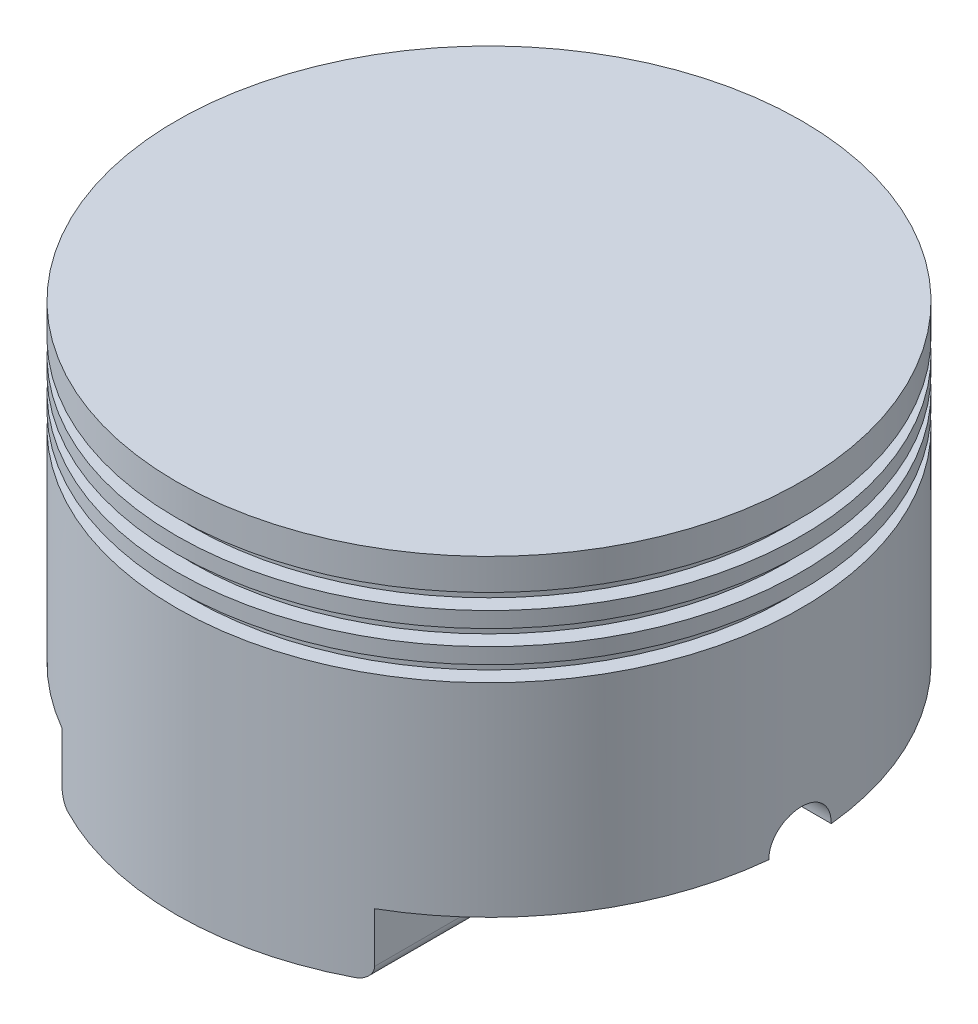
SolidWorks part; units mm, degrees
ref_plane "Front Plane" through (0, 0, 0) normal (0, 0, 1) x (1, 0, 0)
ref_plane "Top Plane" through (0, 0, 0) normal (0, 1, 0) x (1, 0, 0)
ref_plane "Right Plane" through (0, 0, 0) normal (1, 0, 0) x (0, 0, -1)
sketch "Sketch1" plane through (0, 0, 0) normal (0, 0, 1) x (1, 0, 0)
  line L0 (-31.75, 31.75) -> (-31.75, 38.1)
  line L1 (-31.75, -38.1) -> (31.75, -38.1)
  line L2 (-31.75, -38.1) -> (-31.75, 15.875)
  line L3 (-31.75, 38.1) -> (31.75, 38.1)
  line L4 (31.75, -38.1) -> (31.75, 38.1)
  line L5 (-31.75, -38.1) -> (31.75, 38.1) construction
  line L6 (-31.75, 38.1) -> (31.75, -38.1) construction
  line L7 (-31.75, 31.75) -> (-28.575, 31.75)
  line L9 (-31.75, 28.575) -> (-28.575, 28.575)
  line L10 (-28.575, 31.75) -> (-28.575, 28.575)
  line L11 (-31.75, 31.75) -> (-28.575, 28.575) construction
  line L12 (-31.75, 28.575) -> (-28.575, 31.75) construction
  line L13 (-31.75, 25.4) -> (-28.575, 25.4)
  line L15 (-31.75, 22.225) -> (-28.575, 22.225)
  line L16 (-28.575, 25.4) -> (-28.575, 22.225)
  line L17 (-31.75, 25.4) -> (-28.575, 22.225) construction
  line L18 (-31.75, 22.225) -> (-28.575, 25.4) construction
  line L19 (-31.75, 19.05) -> (-28.575, 19.05)
  line L21 (-31.75, 15.875) -> (-28.575, 15.875)
  line L22 (-28.575, 19.05) -> (-28.575, 15.875)
  line L23 (-31.75, 19.05) -> (-28.575, 15.875) construction
  line L24 (-31.75, 15.875) -> (-28.575, 19.05) construction
  line L25 (-31.75, 25.4) -> (-31.75, 28.575)
  line L26 (-31.75, 19.05) -> (-31.75, 22.225)
  point P0 (0, 0)
  point P5 (-30.1625, 30.1625)
  point P11 (-30.1625, 23.8125)
  point P16 (-30.1625, 17.4625)
  point P21 (0, 0)
  point P22 (-30.1625, 30.1625)
  point P23 (-30.1625, 23.8125)
  point P24 (-30.1625, 17.4625)
  point P25 (0, 0)
  dimension "D1" = 76.2
  dimension "D2" = 63.5
  dimension "D3" = 3.175
  dimension "D4" = 6.35
  dimension "D5" = 3.175
  dimension "D6" = 3.175
  dimension "D7" = 3.175
  dimension "D8" = 3.175
  dimension "D9" = 3.175
  dimension "D10" = 3.175
  dimension "D11" = 3.175
revolve "Revolve1" add sketch "Sketch1" angle 360 about L4
sketch "Sketch2" plane through (0, -38.1, 0) normal (0, -1, 0) x (1, 0, 0)
  circle A0 centre (31.75, 0) radius 57.15
  dimension "D1" = 114.3
extrude "Cut-Extrude1" cut sketch "Sketch2" against normal blind 50.8
sketch "Sketch5" plane through (0, 0, 0) normal (0, 0, 1) x (1, 0, 0)
  line L1 (0, -25.4) -> (-63.5, -25.4)
  line L2 (0, -25.4) -> (0, -50.8)
  line L3 (0, -50.8) -> (-63.5, -50.8)
  line L4 (-63.5, -25.4) -> (-63.5, -50.8)
  line L5 (0, -25.4) -> (-63.5, -50.8) construction
  line L6 (0, -50.8) -> (-63.5, -25.4) construction
  line L7 (63.5, -50.8) -> (127, -50.8)
  line L8 (63.5, -50.8) -> (63.5, -25.4)
  line L9 (63.5, -25.4) -> (127, -25.4)
  line L10 (127, -50.8) -> (127, -25.4)
  line L11 (63.5, -50.8) -> (127, -25.4) construction
  line L12 (63.5, -25.4) -> (127, -50.8) construction
  point P0 (-31.75, -38.1)
  point P5 (95.25, -38.1)
  dimension "D1" = 25.4
  dimension "D2" = 63.5
  dimension "D3" = 25.4
  dimension "D4" = 63.5
extrude "Cut-Extrude3" cut sketch "Sketch5" against normal through all both and the other way through all
sketch "Sketch6" plane through (0, 12.7, 0) normal (0, -1, 0) x (1, 0, 0)
  line L0 (0, 54.9926) -> (0, 47.519) construction
  line L1 (12.7, 25.4) -> (6.35, 25.4)
  line L2 (12.7, 25.4) -> (12.7, -25.4)
  line L3 (12.7, -25.4) -> (6.35, -25.4)
  line L4 (0, 25.4) -> (0, -25.4)
  line L5 (12.7, 25.4) -> (0, -25.4) construction
  line L6 (12.7, -25.4) -> (0, 25.4) construction
  line L7 (0, 25.4) -> (0, 47.519)
  line L8 (6.35, 25.4) -> (6.35, 51.1953)
  line L9 (6.35, -25.4) -> (6.35, -51.1953)
  line L10 (0, -25.4) -> (0, -47.519)
  line L11 (31.75, 57.15) -> (31.75, -57.15) construction
  line L12 (50.8, -25.4) -> (57.15, -25.4)
  line L13 (57.15, -25.4) -> (57.15, -51.1953)
  line L14 (63.5, -25.4) -> (63.5, -47.519)
  line L15 (63.5, 25.4) -> (63.5, -25.4)
  line L16 (63.5, 25.4) -> (63.5, 47.519)
  line L17 (57.15, 25.4) -> (57.15, 51.1953)
  line L18 (50.8, 25.4) -> (57.15, 25.4)
  line L19 (50.8, 25.4) -> (50.8, -25.4)
  circle A0 centre (31.75, 0) radius 57.15
  arc A1 (0, 47.519) -> (0, -47.519) centre (31.75, 0) ccw construction
  point P0 (6.35, 0)
  dimension "D3" = 114.3
  dimension "D4" = 0
  dimension "D7" = 22.119
  dimension "D1" = 50.8
  dimension "D2" = 12.7
  dimension "D5" = 0
  dimension "D6" = 6.35
  dimension "D8" = 22.119
  dimension "D9" = 6.35
  dimension "D10" = 25.7953
  dimension "D11" = 31.75
  dimension "D12" = 6.35
  dimension "D13" = 6.35
extrude "Boss-Extrude2" add sketch "Sketch6" along normal up to surface (50.8 mm away) contours L4 L10 L9 L3 L2 L1 L8 L7 M5 | L18 L19 L12 L13 L14 L15 L16 L17 M5
sketch "Sketch8" plane through (0, 0, 0) normal (1, 0, 0) x (0, 0, -1)
  line L0 (-54.9926, -25.4) -> (54.9926, -25.4) construction
  circle A0 centre (0, -25.4) radius 6.35
  dimension "D1" = 12.7
extrude "Cut-Extrude5" cut sketch "Sketch8" against normal through all both and the other way through all
fillet "Fillet1" radius 2.54 12 edges at (57.15, -38.1, 38.2977) (53.975, -38.1, 25.4) (53.975, -38.1, -25.4) (57.15, -38.1, -38.2977) (6.35, -38.1, -38.2977) (9.525, -38.1, -25.4) (9.525, -38.1, 25.4) (6.35, -38.1, 38.2977) (12.7, -38.1, 0) (50.8, -38.1, 0) (63.5, -38.1, 0) (0, -38.1, 0)
sketch "Sketch9" plane through (63.5, 0, 0) normal (1, 0, 0) x (0, 0, -1)
  circle A0 centre (0, -25.4) radius 8.509
  dimension "D1" = 17.018
extrude "Cut-Extrude6" cut sketch "Sketch9" along direction (-1, 0, 0) on the side against the normal offset from surface (39.624 mm away) 6.096 from offset 5.08
sketch "Sketch11" plane through (58.42, 0, 0) normal (-1, 0, 0) x (0, 0, 1)
  circle A0 centre (0, -25.4) radius 6.35
  dimension "D1" = 12.7
extrude "Cut-Extrude7" cut sketch "Sketch11" against normal blind 6.35 draft 25
ref_plane "Plane1" through (31.75, 0, 0) normal (1, 0, 0) x (0, 0, -1)
mirror "Mirror1" about plane through (31.75, 0, 0) normal (1, 0, 0) of "Cut-Extrude7"
sketch "Sketch13" plane through (0, 0, 0) normal (-1, 0, 0) x (0, 0, 1)
  circle A0 centre (0, -25.4) radius 8.509
  dimension "D1" = 17.018
extrude "Cut-Extrude12" cut sketch "Sketch13" along direction (1, 0, 0) on the side against the normal offset from surface (1.27 mm away) 6.35 from offset 5.08
